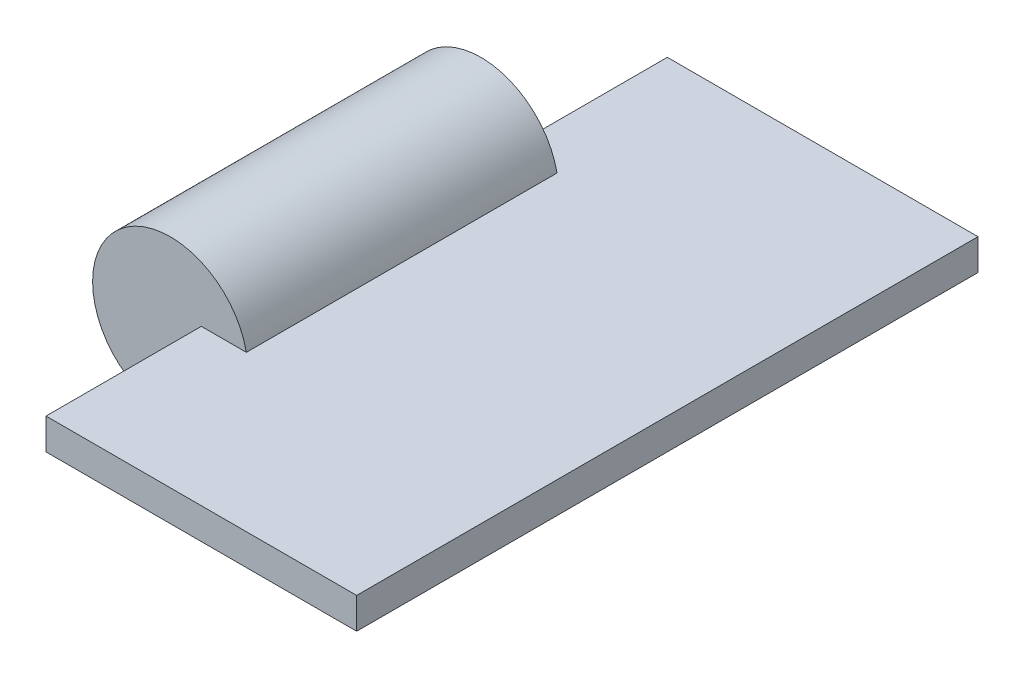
SolidWorks part; units mm, degrees
ref_plane "Front Plane" through (0, 0, 0) normal (0, 0, 1) x (1, 0, 0)
ref_plane "Top Plane" through (0, 0, 0) normal (0, 1, 0) x (1, 0, 0)
ref_plane "Right Plane" through (0, 0, 0) normal (1, 0, 0) x (0, 0, -1)
sketch "Sketch1" plane through (0, 0, 0) normal (0, 0, 1) x (1, 0, 0)
  circle A0 centre (0, 0) radius 5
  dimension "D1" = 10
extrude "Boss-Extrude1" add sketch "Sketch1" along normal blind 20
sketch "Sketch2" plane through (0, 0, 0) normal (0, 1, 0) x (1, 0, 0)
  line L0 (2, 10) -> (2, -30)
  line L1 (2, 10) -> (22, 10)
  line L2 (22, 10) -> (22, -30)
  line L3 (22, -30) -> (2, -30)
  line L4 (5, 0) -> (-5, 0) construction
  line L6 (-5, -20) -> (5, -20) construction
  line L7 (-5, 0) -> (-5, -20) construction
  dimension "D1" = 10
  dimension "D2" = 10
  dimension "D3" = 20
  dimension "D4" = 7
extrude "Boss-Extrude2" add sketch "Sketch2" along normal mid plane 2
